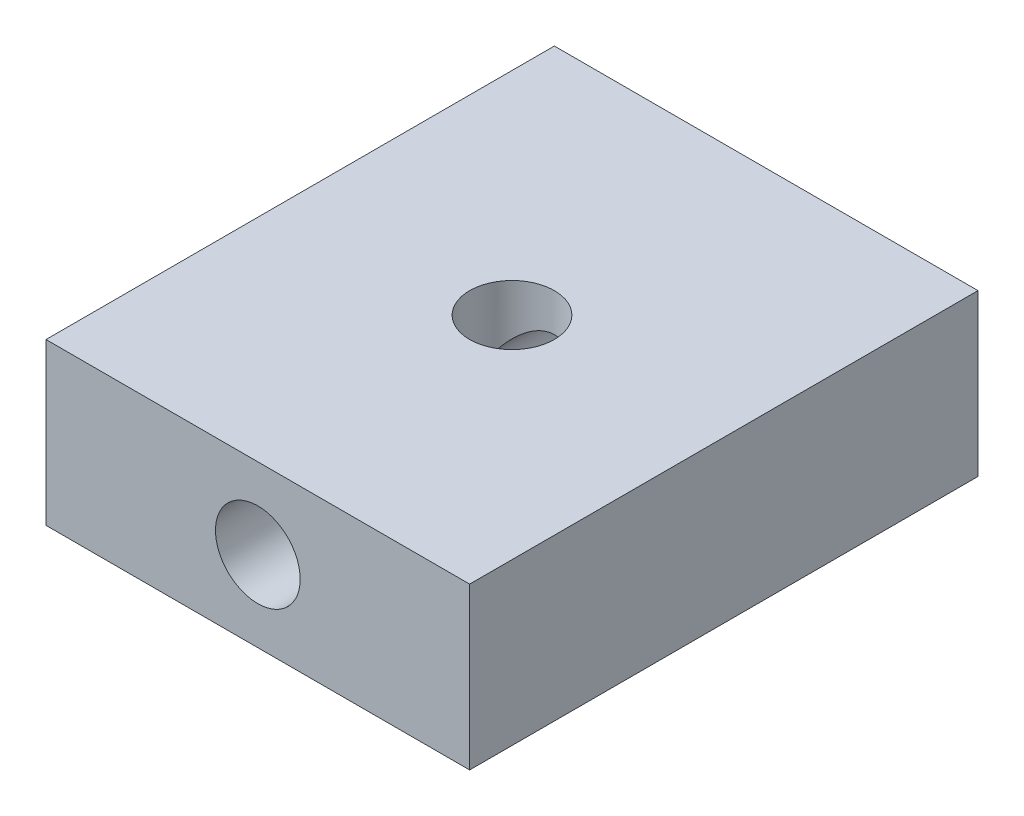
SolidWorks part; units mm, degrees
ref_plane "Front Plane" through (0, 0, 0) normal (0, 0, 1) x (1, 0, 0)
ref_plane "Top Plane" through (0, 0, 0) normal (0, 1, 0) x (1, 0, 0)
ref_plane "Right Plane" through (0, 0, 0) normal (1, 0, 0) x (0, 0, -1)
sketch "Sketch1" plane through (0, 0, 0) normal (0, 1, 0) x (1, 0, 0)
  line L1 (-25, 30) -> (25, 30)
  line L2 (-25, 30) -> (-25, -30)
  line L3 (-25, -30) -> (25, -30)
  line L4 (25, 30) -> (25, -30)
  line L5 (-25, 30) -> (25, -30) construction
  line L6 (-25, -30) -> (25, 30) construction
  point P0 (0, 0)
  dimension "D1" = 50
  dimension "D2" = 60
extrude "Boss-Extrude1" add sketch "Sketch1" along normal blind 19
sketch "Sketch2" plane through (0, 0, 30) normal (0, 0, 1) x (1, 0, 0)
  line L0 (0, 24.1077) -> (0, -2.5052) construction
  line L1 (-27.6203, 9.5) -> (28.9636, 9.5) construction
  circle A0 centre (0, 9.5) radius 5
  dimension "D1" = 10
extrude "Cut-Extrude1" cut sketch "Sketch2" against normal through all
sketch "Sketch3" plane through (0, 19, 0) normal (0, 1, 0) x (1, 0, 0)
  circle A0 centre (0, 0) radius 5
  dimension "D1" = 10
extrude "Cut-Extrude2" cut sketch "Sketch3" against normal blind 9
